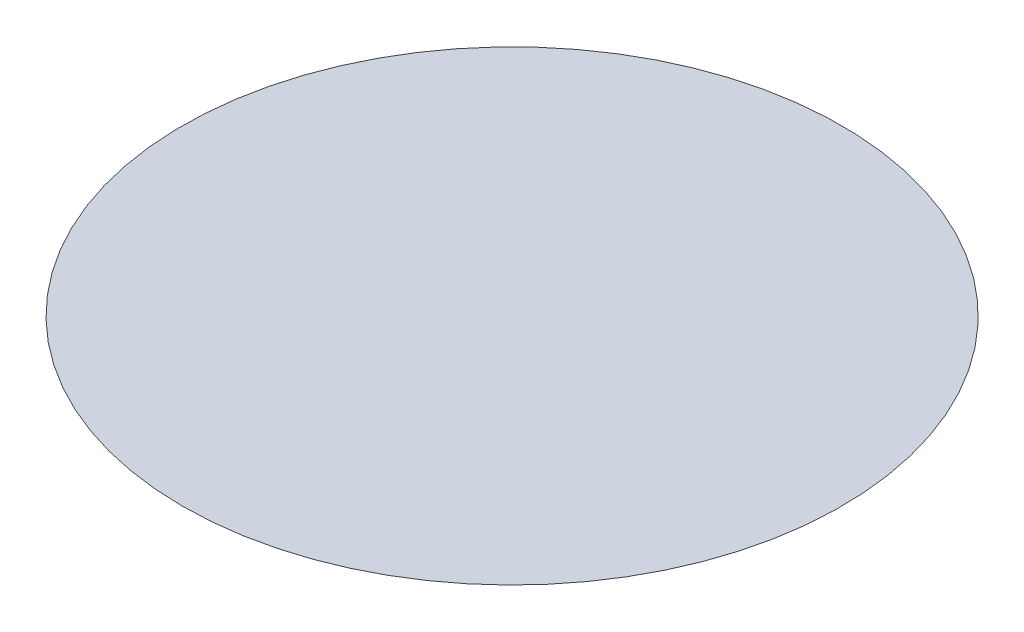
SolidWorks part; units mm, degrees
ref_plane "Plane1" through (0, 0, 0) normal (0, 0, 1) x (1, 0, 0)
ref_plane "Plane2" through (0, 0, 0) normal (0, 1, 0) x (1, 0, 0)
ref_plane "Plane3" through (0, 0, 0) normal (1, 0, 0) x (0, 0, -1)
sketch "Sketch1" plane through (0, 0, 0) normal (0, 0, 1) x (1, 0, 0)
  line L0 (-20.6503, 0) -> (20.6503, 0)
  line L1 (-20.6503, 0) -> (-20.6503, 2)
  line L2 (20.6503, 2) -> (-20.6503, 2)
  line L3 (20.6503, 2) -> (20.6503, 0)
  line L4 (50, 0) -> (-50, 0) construction
  line L5 (0, -25.996) -> (0, 39.4685) construction
  dimension "D1" = 2
extrude "Base-Extrude" add sketch "Sketch1" along normal mid plane 50
sketch "Sketch5" plane through (0, 0, 0) normal (0, 0, 1) x (1, 0, 0)
  line L0 (-20.6503, 0) -> (20.6503, 0) construction
  line L1 (16.5831, 0) -> (0, 0)
  line L2 (0, 0) -> (0, -5)
  line L3 (0, 10.1617) -> (0, -6.2495) construction
  arc A0 (0, -5) -> (16.5831, 0) centre (0, 25) ccw
  dimension "Diameter" = 60
  dimension "Height from Drop Face" = 5
revolve "Boss-Revolve1" add sketch "Sketch5" angle 360 about L3
fillet "Fillet1" radius 10 1 edges at (0, 0, 16.5831)
sketch "Sketch4" plane through (20.6503, 0, 0) normal (1, 0, 0) x (0, 0, -1)
  line L4 (25, 0) -> (25, 2)
  line L5 (25, 2) -> (-25, 2)
  line L6 (-25, 2) -> (-25, 0)
  line L7 (-25, 0) -> (25, 0)
  line L8 (25, 0) -> (25, 2)
  line L9 (25, 2) -> (-25, 2)
  line L10 (-25, 2) -> (-25, 0)
  line L11 (-25, 0) -> (25, 0)
  dimension "D1" = 0
extrude "Cut-Extrude1" cut sketch "Sketch4" against normal through all
sketch "Orientation sketch" plane through (0, 0, 0) normal (0, 1, 0) x (-1, 0, 0)
  circle A1 centre (0, 0) radius 19.3649
  circle A2 centre (0, 0) radius 19.3649
  dimension "D1" = 0
